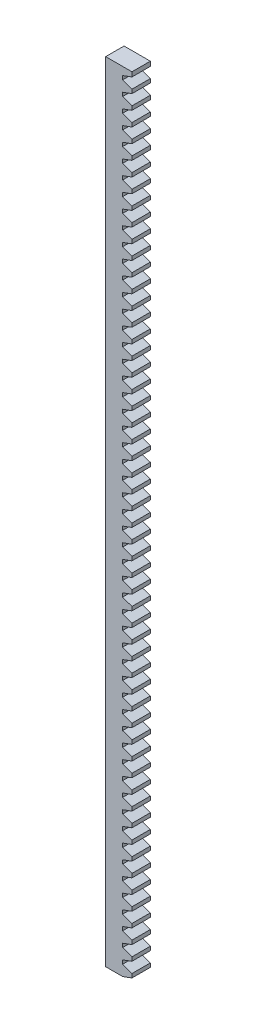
SolidWorks part; units mm, degrees
ref_plane "Front Plane" through (0, 0, 0) normal (0, 0, 1) x (1, 0, 0)
ref_plane "Top Plane" through (0, 0, 0) normal (0, 1, 0) x (1, 0, 0)
ref_plane "Right Plane" through (0, 0, 0) normal (1, 0, 0) x (0, 0, -1)
sketch "Sketch1" plane through (0, 0, 0) normal (0, 0, 1) x (1, 0, 0)
  line L0 (-1.8, -7.5274) -> (1.75, -6.2353)
  line L1 (1.75, -6.2353) -> (1.75, -4.7603)
  line L2 (1.75, -4.7603) -> (-1.8, -3.4682)
  line L3 (-1.8, -3.4682) -> (-1.8, -2.0296)
  line L4 (-1.8, -2.0296) -> (1.75, -0.7375)
  line L5 (1.75, -0.7375) -> (1.75, 0.7375)
  line L6 (1.75, 0.7375) -> (-1.8, 2.0296)
  line L7 (-1.8, 2.0296) -> (-1.8, 3.4682)
  line L8 (-1.8, 3.4682) -> (1.75, 4.7603)
  line L9 (1.75, 4.7603) -> (1.75, 6.2353)
  line L10 (1.75, 6.2353) -> (-1.8, 7.5274)
  line L11 (-1.8, 7.5274) -> (-4.5489, 7.5274)
  line L12 (-4.5489, 7.5274) -> (-4.5489, -7.5274)
  line L13 (-4.5489, -7.5274) -> (-1.8, -7.5274)
  line L14 (-1.8, -7.5274) -> (1.75, -6.2353)
  line L15 (1.75, -6.2353) -> (1.75, -4.7603)
  line L16 (1.75, -4.7603) -> (-1.8, -3.4682)
  line L17 (-1.8, -3.4682) -> (-1.8, -2.0296)
  line L18 (-1.8, -2.0296) -> (1.75, -0.7375)
  line L19 (1.75, -0.7375) -> (1.75, 0.7375)
  line L20 (1.75, 0.7375) -> (-1.8, 2.0296)
  line L21 (-1.8, 2.0296) -> (-1.8, 3.4682)
  line L22 (-1.8, 3.4682) -> (1.75, 4.7603)
  line L23 (1.75, 4.7603) -> (1.75, 6.2353)
  line L24 (1.75, 6.2353) -> (-1.8, 7.5274)
  line L25 (-1.8, 7.5274) -> (-4.5489, 7.5274)
  line L26 (-4.5489, 7.5274) -> (-4.5489, -7.5274)
  line L27 (-4.5489, -7.5274) -> (-1.8, -7.5274)
sketch "Sketch2" plane through (0, 0, 0) normal (0, 0, 1) x (1, 0, 0)
  line L0 (-8.25, 292.4726) -> (-8.25, -7.5274)
  line L1 (-8.25, -7.5274) -> (1.75, -7.5274)
  line L2 (1.75, -7.5274) -> (1.75, 292.4726)
  line L3 (1.75, 292.4726) -> (-8.25, 292.4726)
  line L4 (1.75, -6.2353) -> (1.75, -4.7603) construction
  line L5 (-4.5489, -7.5274) -> (-1.8, -7.5274) construction
  dimension "D1" = 300
  dimension "D2" = 10
extrude "Boss-Extrude1" add sketch "Sketch2" along normal blind 7
sketch "Sketch4" plane through (0, 0, 0) normal (0, 0, 1) x (1, 0, 0)
  line L0 (1.75, -0.7375) -> (-1.8, -2.0296)
  line L1 (-1.8, -2.0296) -> (-1.8, -3.4682)
  line L2 (-1.8, -3.4682) -> (1.75, -4.7603)
  line L3 (1.75, -4.7603) -> (1.75, -0.7375)
extrude "Cut-Extrude2" cut sketch "Sketch4" along normal through all
pattern_linear "LPattern1" count 54 spacing 5.5 along (0, 1, 0) count 54 spacing 5.5 along (0.342, -0.9397, 0) of "Cut-Extrude2"
